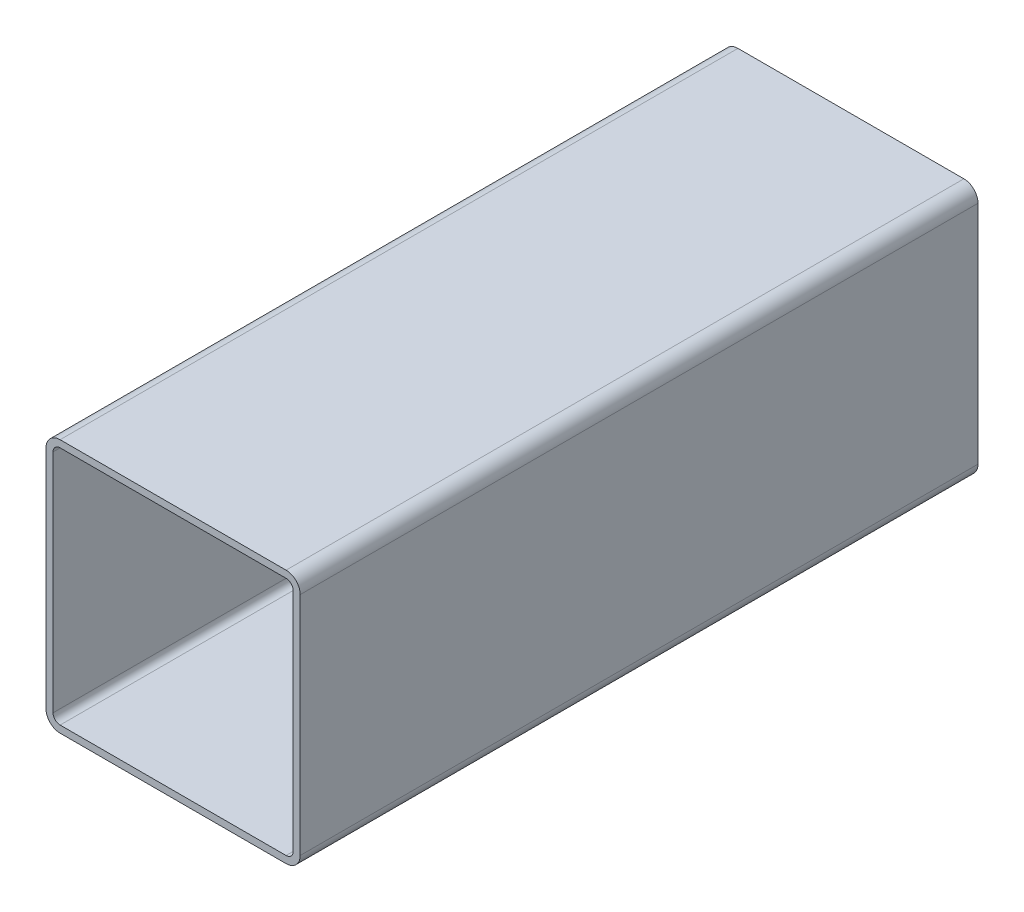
SolidWorks part; units mm, degrees
ref_plane "Front Plane" through (0, 0, 0) normal (0, 0, 1) x (1, 0, 0)
ref_plane "Top Plane" through (0, 0, 0) normal (0, 1, 0) x (1, 0, 0)
ref_plane "Right Plane" through (0, 0, 0) normal (1, 0, 0) x (0, 0, -1)
sketch "Sketch1" plane through (0, 0, 0) normal (0, 0, 1) x (1, 0, 0)
sketch_block_instance "HSS4.5x4.5x0.125-1"
sketch_block "HSS4.5x4.5x0.125"
extrude "Boss-Extrude1" add sketch "Sketch1" along normal blind 304.8
